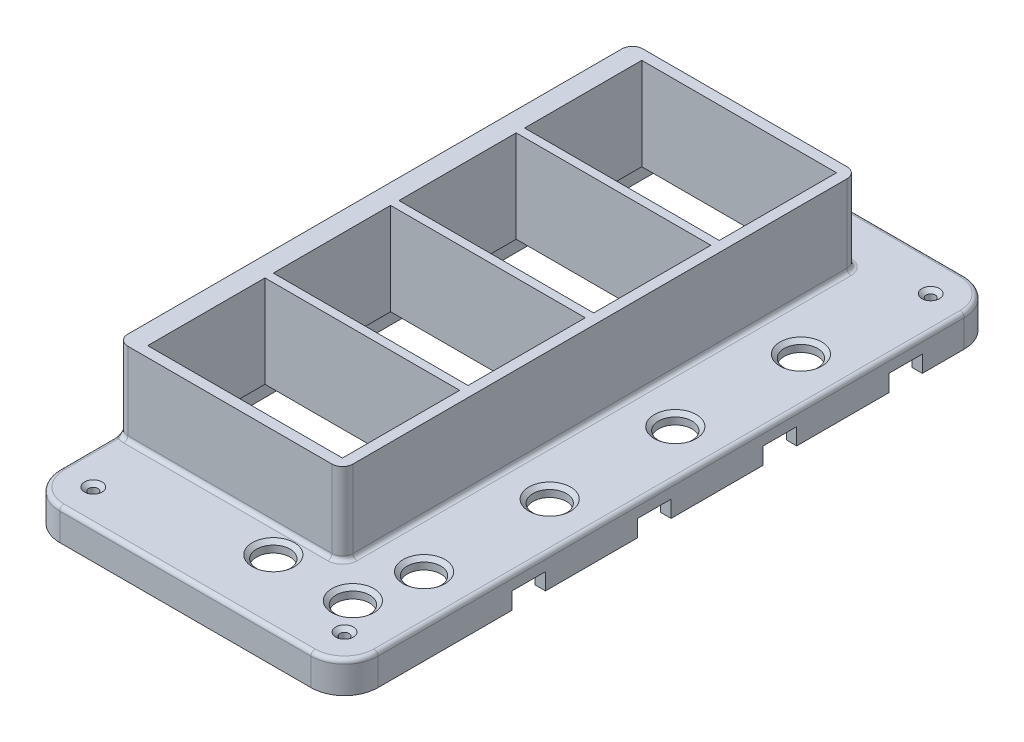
SolidWorks part; units mm, degrees
ref_plane "Спереди" through (0, 0, 0) normal (0, 0, 1) x (1, 0, 0)
ref_plane "Сверху" through (0, 0, 0) normal (0, 1, 0) x (1, 0, 0)
ref_plane "Справа" through (0, 0, 0) normal (1, 0, 0) x (0, 0, -1)
sketch "Эскиз1" plane through (0, 0, 0) normal (0, 1, 0) x (1, 0, 0)
  line L0 (-35.5, -75.5) -> (-35.5, 75.5)
  line L1 (-38, -78) -> (38, -78)
  line L2 (-38, -78) -> (-38, 78)
  line L3 (-38, 78) -> (38, 78)
  line L4 (38, -78) -> (38, 78)
  line L5 (-38, -78) -> (38, 78) construction
  line L6 (-38, 78) -> (38, -78) construction
  line L7 (-35.5, 75.5) -> (35.5, 75.5)
  line L8 (35.5, -75.5) -> (35.5, 75.5)
  line L9 (-35.5, -75.5) -> (35.5, -75.5)
  point P0 (0, 0)
  dimension "D1" = 76
  dimension "D2" = 156
  dimension "D3" = 2.5
extrude "Бобышка-Вытянуть1" add sketch "Эскиз1" along normal blind 5
sketch "Эскиз2" plane through (0, 5, 0) normal (0, 1, 0) x (1, 0, 0)
  line L0 (0, 0) -> (0, 54.1214) construction
  line L1 (-38, 78) -> (38, 78)
  line L2 (-38, 78) -> (-38, -78)
  line L3 (-38, -78) -> (38, -78)
  line L4 (38, 78) -> (38, -78)
  line L5 (0, 0) -> (38, 0) construction
  line L6 (35.5, -75.5) -> (35.5, 75.5) construction
  line L7 (-33.25, 36.25) -> (13.25, 36.25)
  line L8 (-33.25, 36.25) -> (-33.25, 64.25)
  line L9 (-33.25, 64.25) -> (13.25, 64.25)
  line L10 (13.25, 36.25) -> (13.25, 64.25)
  line L11 (35.5, 75.5) -> (-35.5, 75.5) construction
  line L12 (-35.5, 75.5) -> (-35.5, -75.5) construction
  line L13 (-33.25, 6.25) -> (-33.25, 34.25)
  line L14 (-33.25, 6.25) -> (13.25, 6.25)
  line L15 (13.25, 6.25) -> (13.25, 34.25)
  line L16 (-33.25, 34.25) -> (13.25, 34.25)
  line L17 (-33.25, -23.75) -> (-33.25, 4.25)
  line L18 (-33.25, -23.75) -> (13.25, -23.75)
  line L19 (13.25, -23.75) -> (13.25, 4.25)
  line L20 (-33.25, 4.25) -> (13.25, 4.25)
  line L21 (-33.25, -53.75) -> (-33.25, -25.75)
  line L22 (-33.25, -53.75) -> (13.25, -53.75)
  line L23 (13.25, -53.75) -> (13.25, -25.75)
  line L24 (-33.25, -25.75) -> (13.25, -25.75)
  circle A0 centre (-30, 70) radius 1.1
  circle A1 centre (30, 70) radius 1.1
  circle A2 centre (30, -70) radius 1.1
  circle A3 centre (-30, -70) radius 1.1
  circle A4 centre (27, 42) radius 4
  circle A5 centre (27, 12) radius 4
  circle A6 centre (27, -18) radius 4
  circle A7 centre (27, -48) radius 4
  dimension "D1" = 2.2
  dimension "D2" = 8
  dimension "D3" = 8
  dimension "D9" = 33.5
  dimension "D10" = 8
  dimension "D4" = 46.5
  dimension "D5" = 28
  dimension "D6" = 2.25
  dimension "D7" = 11.25
  dimension "D8" = 8.5
  dimension "D12" = 30
  dimension "D11" = 4
extrude "Бобышка-Вытянуть2" add sketch "Эскиз2" along normal blind 2.5
sketch "Эскиз3" plane through (0, 7.5, 0) normal (0, 1, 0) x (1, 0, 0)
  line L0 (-38, 78) -> (-38, -78) construction
  line L1 (-38, 66.75) -> (15.75, 66.75)
  line L2 (-38, 66.75) -> (-38, -56.25)
  line L3 (-38, -56.25) -> (15.75, -56.25)
  line L4 (15.75, 66.75) -> (15.75, -56.25)
  line L5 (-33.25, 34.25) -> (-33.25, 6.25)
  line L6 (-33.25, 64.25) -> (13.25, 64.25)
  line L7 (-33.25, 64.25) -> (-33.25, 36.25)
  line L8 (-33.25, 36.25) -> (13.25, 36.25)
  line L9 (13.25, 64.25) -> (13.25, 36.25)
  line L10 (-33.25, 34.25) -> (13.25, 34.25)
  line L11 (13.25, 34.25) -> (13.25, 6.25)
  line L12 (-33.25, 6.25) -> (13.25, 6.25)
  line L13 (-33.25, 4.25) -> (-33.25, -23.75)
  line L14 (-33.25, 4.25) -> (13.25, 4.25)
  line L15 (13.25, 4.25) -> (13.25, -23.75)
  line L16 (-33.25, -23.75) -> (13.25, -23.75)
  line L17 (-33.25, -25.75) -> (-33.25, -53.75)
  line L18 (-33.25, -25.75) -> (13.25, -25.75)
  line L19 (13.25, -25.75) -> (13.25, -53.75)
  line L20 (-33.25, -53.75) -> (13.25, -53.75)
  dimension "D2" = 30
  dimension "D3" = 2.5
  dimension "D4" = 2.5
  dimension "D5" = 2.5
  dimension "D1" = 4
extrude "Бобышка-Вытянуть3" add sketch "Эскиз3" along normal blind 19.5
sketch "Эскиз4" plane through (35.5, 0, 0) normal (-1, 0, 0) x (0, 0, 1)
  line L0 (75.5, 0) -> (-75.5, 0) construction
  line L1 (-60, 4) -> (-52, 4)
  line L2 (-60, 4) -> (-60, 0)
  line L3 (-60, 0) -> (-52, 0)
  line L4 (-52, 4) -> (-52, 0)
  line L5 (-60, 4) -> (-52, 0) construction
  line L6 (-60, 0) -> (-52, 4) construction
  line L7 (-75.5, 5) -> (-75.5, 0) construction
  line L8 (-30, 4) -> (-30, 0)
  line L9 (-30, 4) -> (-22, 4)
  line L10 (-22, 4) -> (-22, 0)
  line L11 (-30, 0) -> (-22, 0)
  line L12 (0, 4) -> (0, 0)
  line L13 (0, 4) -> (8, 4)
  line L14 (8, 4) -> (8, 0)
  line L15 (0, 0) -> (8, 0)
  line L16 (30, 4) -> (30, 0)
  line L17 (30, 4) -> (38, 4)
  line L18 (38, 4) -> (38, 0)
  line L19 (30, 0) -> (38, 0)
  point P0 (-56, 2)
  dimension "D1" = 8
  dimension "D2" = 4
  dimension "D3" = 19.5
  dimension "D5" = 30
  dimension "D4" = 4
extrude "Вырез-Вытянуть1" cut sketch "Эскиз4" against normal through all contours L2 L3 L4 L1
fillet "Скругление1" radius 8 4 edges at (-38, 3.75, -78) (38, 3.75, -78) (38, 3.75, 78) (-38, 3.75, 78)
fillet "Скругление2" radius 5.5 4 edges at (35.5, 2.5, 75.5) (-35.5, 2.5, 75.5) (-35.5, 2.5, -75.5) (35.5, 2.5, -75.5)
fillet "Скругление3" radius 2.5 4 edges at (-38, 17.25, -66.75) (15.75, 17.25, -66.75) (-38, 17.25, 56.25) (15.75, 17.25, 56.25)
fillet "Скругление4" radius 1 7 edges at (-37.2678, 7.5, 55.5178) (-11.125, 7.5, 56.25) (15.0178, 7.5, 55.5178) (-37.2678, 7.5, -66.0178) (-11.125, 7.5, -66.75) (15.0178, 7.5, -66.0178) (15.75, 7.5, -5.25)
chamfer "Фаска1" distance 1 angle 40 8 edges at (-30, 7.5, -68.9) (-30, 7.5, 68.9) (30, 7.5, 71.1) (27, 7.5, 52) (27, 7.5, 22) (27, 7.5, -8) (27, 7.5, -38) (30, 7.5, -71.1)
fillet "Скругление5" radius 1 11 edges at (-38, 7.633, 55.4114) (-38, 7.633, -65.9114) (-38, 7.5, -68.3497) (-35.6569, 7.5, -75.6569) (0, 7.5, -78) (35.6569, 7.5, -75.6569) (38, 7.5, 0) (35.6569, 7.5, 75.6569) (0, 7.5, 78) (-35.6569, 7.5, 75.6569) (-38, 7.5, 63.0997)
sketch "Эскиз5" plane through (0, 7.5, 0) normal (0, 1, 0) x (1, 0, 0)
  line L0 (24.5, -62.5) -> (5.5, -62.5) construction
  circle A0 centre (24.5, -62.5) radius 4
  circle A1 centre (5.5, -62.5) radius 4
  circle A2 centre (30, -70) radius 1.1 construction
  dimension "D1" = 8
  dimension "D2" = 8
  dimension "D4" = 7.5
  dimension "D5" = 19
  dimension "D3" = 5.5
extrude "Вырез-Вытянуть2" cut sketch "Эскиз5" against normal through all
chamfer "Фаска2" distance 1 angle 40 2 edges at (24.5, 7.5, 66.5) (5.5, 7.5, 66.5)
